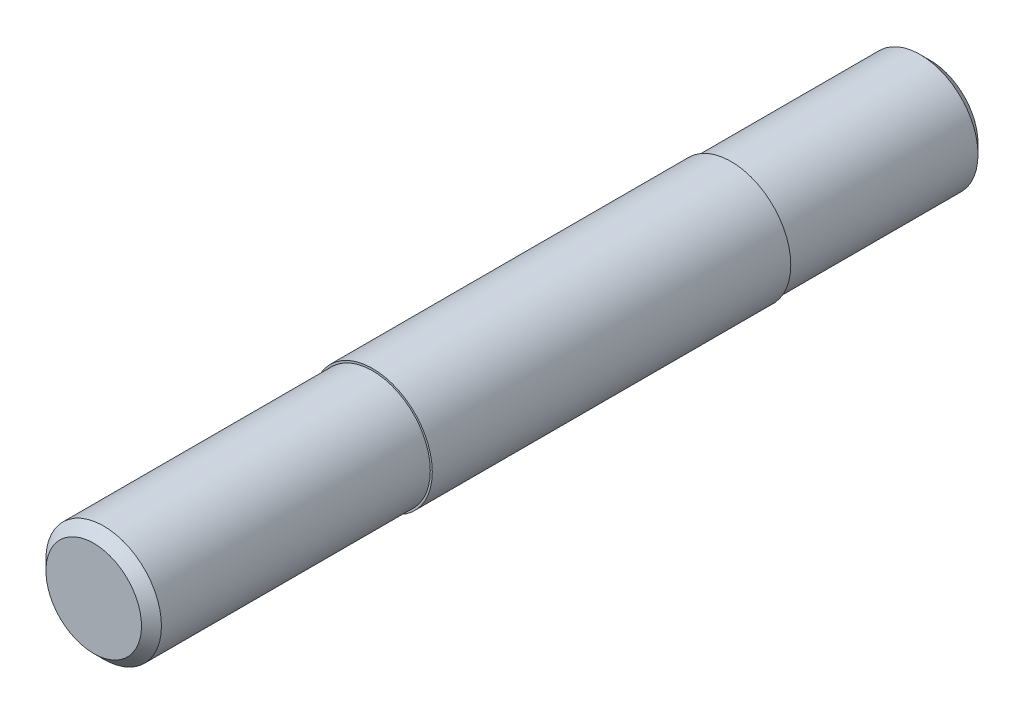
SolidWorks part; units mm, degrees
ref_plane "Plan1" through (0, 0, 0) normal (0, 0, 1) x (1, 0, 0)
ref_plane "Plan2" through (0, 0, 0) normal (0, 1, 0) x (1, 0, 0)
ref_plane "Plan3" through (0, 0, 0) normal (1, 0, 0) x (0, 0, -1)
sketch "Esquisse3" plane through (0, 0, 0) normal (0, 0, 1) x (1, 0, 0)
  circle A0 centre (0, 0) radius 2.9
extrude "Base-Extrusion" add sketch "Esquisse3" along normal blind 10
sketch "Esquisse4" plane through (0, 0, 10) normal (0, 0, 1) x (1, 0, 0)
  circle A0 centre (0, 0) radius 3
extrude "Boss.-Extru.1" add sketch "Esquisse4" along normal blind 18
sketch "Esquisse5" plane through (0, 0, 28) normal (0, 0, 1) x (1, 0, 0)
  circle A0 centre (0, 0) radius 2.9
extrude "Boss.-Extru.2" add sketch "Esquisse5" along normal blind 14
chamfer "Chanfrein1" distance 0.5 angle 45
